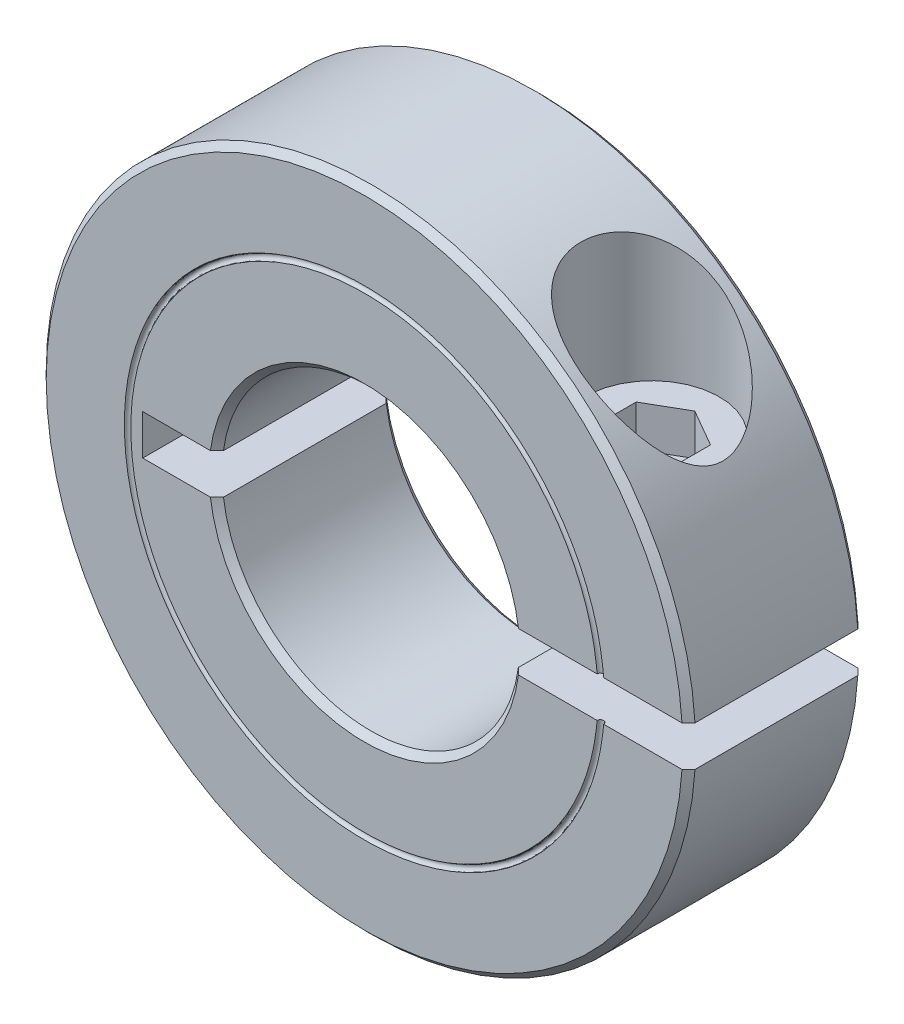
SolidWorks part; units mm, degrees
other "LUMP1"
ref_plane "Front" through (0, 0, 0) normal (0, 0, 1) x (1, 0, 0)
ref_plane "Top" through (0, 0, 0) normal (0, 1, 0) x (1, 0, 0)
ref_plane "Right" through (0, 0, 0) normal (1, 0, 0) x (0, 0, -1)
imported_body "Imported1"
move or copy body "Body-Move/Copy1" bodies to move or copy 101 placed by mates yes
ref_plane "Z Location" through (0, 0, 21.9354) normal (0, 0, 1) x (1, 0, 0)
sketch "Y Location" plane through (0, 0, 21.9354) normal (0, 0, 1) x (1, 0, 0)
  line L0 (0, 0) -> (0, 66.2813) construction
  dimension "BD71" = 66.2813
move or copy body "Body-Move/Copy2" bodies to move or copy 101 placed by mates yes
other "Distance1" parameters "D1"=5.1562
